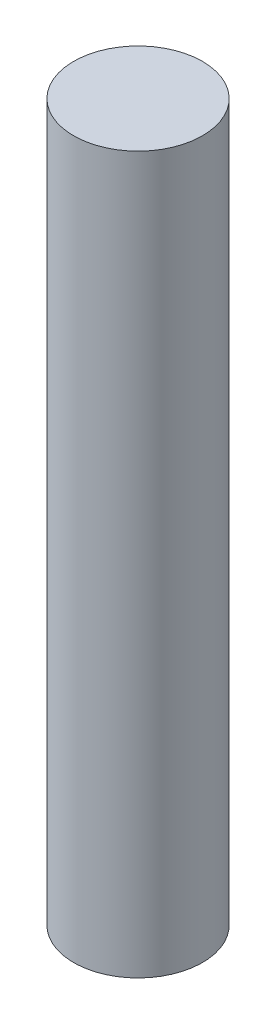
SolidWorks part; units mm, degrees
ref_plane "Front Plane" through (0, 0, 0) normal (0, 0, 1) x (1, 0, 0)
ref_plane "Top Plane" through (0, 0, 0) normal (0, 1, 0) x (1, 0, 0)
ref_plane "Right Plane" through (0, 0, 0) normal (1, 0, 0) x (0, 0, -1)
sketch "Sketch1" plane through (0, 0, 0) normal (0, 0, 1) x (1, 0, 0)
  line L0 (4.5, 50) -> (0, 50)
  line L1 (0, 50) -> (0, 0)
  line L2 (0, 0) -> (4.5, 0)
  line L3 (4.5, 0) -> (4.5, 50)
  line L4 (0, 50) -> (0, 0) construction
revolve "Revolve1" add sketch "Sketch1" angle 360 about L4
